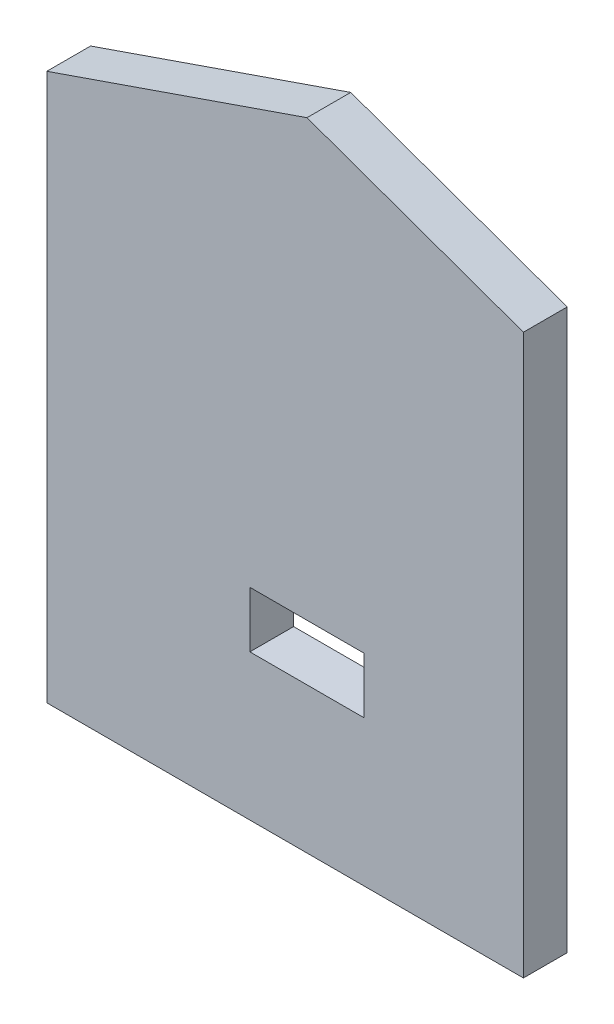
SolidWorks part; units mm, degrees
ref_plane "Plan de face" through (0, 0, 0) normal (0, 0, 1) x (1, 0, 0)
ref_plane "Plan de dessus" through (0, 0, 0) normal (0, 1, 0) x (1, 0, 0)
ref_plane "Plan de droite" through (0, 0, 0) normal (1, 0, 0) x (0, 0, -1)
sketch "Esquisse1" plane through (0, 0, 0) normal (0, 0, 1) x (1, 0, 0)
  line L0 (0, 0) -> (196, 0)
  line L1 (196, 0) -> (196, 230)
  line L2 (196, 230) -> (107, 261.9047)
  line L3 (107, 261.9047) -> (0, 224.93)
  line L4 (0, 224.93) -> (0, 0)
  line L6 (83.5, 82.9047) -> (130.5, 82.9047)
  line L7 (83.5, 82.9047) -> (83.5, 59.9047)
  line L8 (83.5, 59.9047) -> (130.5, 59.9047)
  line L9 (130.5, 82.9047) -> (130.5, 59.9047)
  line L10 (83.5, 82.9047) -> (130.5, 59.9047) construction
  line L11 (83.5, 59.9047) -> (130.5, 82.9047) construction
  arc A0 (115.865, 230) -> (120.3639, 256.4726) centre (196, 230) cw
  point P8 (107, 71.4047)
  point P9 (107, 71.4047)
  dimension "D5" = 190.5
  dimension "D1" = 196
  dimension "D2" = 230
  dimension "D3" = 224.93
  dimension "D4" = 107
  dimension "D6" = 23
  dimension "D7" = 47
  dimension "D8" = 107
extrude "Boss.-Extru.1" add sketch "Esquisse1" along normal blind 18
